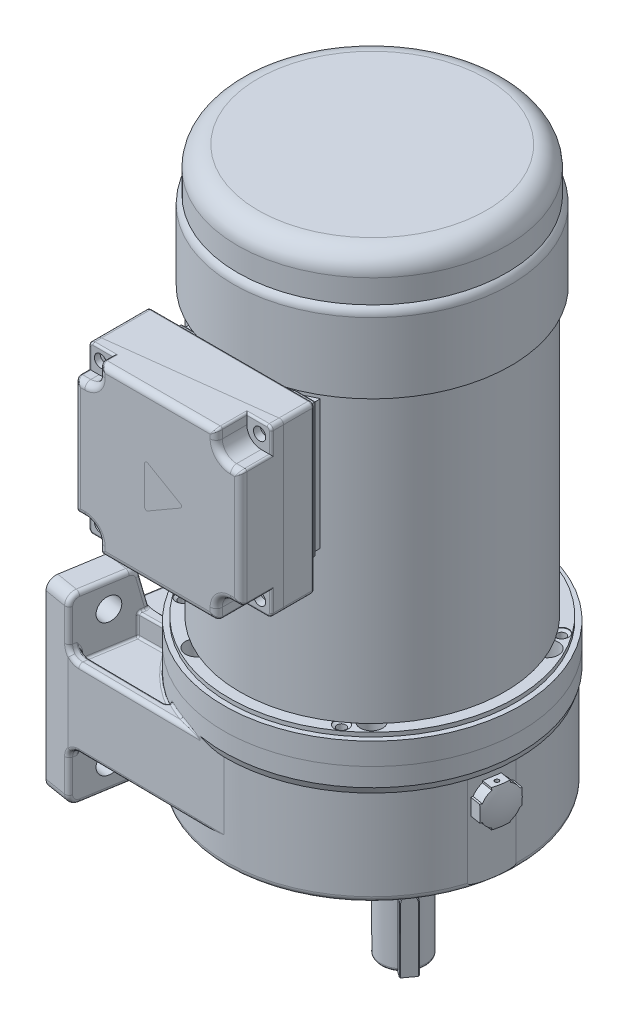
SolidWorks part; units mm, degrees
ref_plane "前视基准面" through (0, 0, 0) normal (0, 0, 1) x (1, 0, 0)
ref_plane "上视基准面" through (0, 0, 0) normal (0, 1, 0) x (1, 0, 0)
ref_plane "右视基准面" through (0, 0, 0) normal (1, 0, 0) x (0, 0, -1)
imported_body "接线盒座-1-surface1"
imported_body "接线盒座-1-surface2"
imported_body "接线盒座-1-surface3"
imported_body "接线盒座-1-surface4"
imported_body "接线盒座-1-surface5"
imported_body "接线盒座-1-surface6"
imported_body "接线盒座-1-surface7"
imported_body "接线盒盖-1-surface1"
imported_body "接线盒盖-1-surface2"
imported_body "接线盒盖-1-surface3"
imported_body "接线盒盖-1-surface4"
imported_body "卧式箱体装配.SLDPRT-1/15.11.08 22箱盖B-1-surface1"
imported_body "卧式箱体装配.SLDPRT-1/3轴22-1-surface1"
imported_body "卧式箱体装配.SLDPRT-1/3轴22-1-surface2"
imported_body "卧式箱体装配.SLDPRT-1/15.05.20 22卧式箱体B-2-surface1"
imported_body "卧式箱体装配.SLDPRT-1/15.05.20 22卧式箱体B-2-surface2"
imported_body "卧式箱体装配.SLDPRT-1/透气塞-1-surface1"
imported_body "卧式箱体装配.SLDPRT-1/7X32-1-surface1"
imported_body "卧式箱体装配.SLDPRT-1/GB／T13871．1-2007唇形密封圈B型B1525X40X7-1-surface1"
sketch "草图1" plane through (0, -157.1427, 0) normal (0, 1, 0) x (1, 0, 0)
  circle A0 centre (438.6108, 106.9711) radius 65
extrude "凸台-拉伸1" add sketch "草图1" along normal blind 140
sketch "草图2" plane through (0, -17.1427, 0) normal (0, 1, 0) x (1, 0, 0)
  circle A0 centre (438.6108, 106.9711) radius 68
extrude "凸台-拉伸2" add sketch "草图2" along normal blind 33.5
sketch "草图3" plane through (0, 16.3573, 0) normal (0, 1, 0) x (1, 0, 0)
  circle A0 centre (438.6108, 106.9711) radius 68
extrude "凸台-拉伸3" add sketch "草图3" along normal blind 5
sketch "草图4" plane through (0, 21.3573, 0) normal (0, 1, 0) x (1, 0, 0)
  circle A0 centre (438.6108, 106.9711) radius 66
extrude "凸台-拉伸4" add sketch "草图4" along normal blind 21.5
fillet "圆角1" radius 10 1 edges at (438.6108, 42.8573, -40.9711)
fillet "圆角2" radius 5 1 edges at (438.6108, 21.3573, -38.9711)
